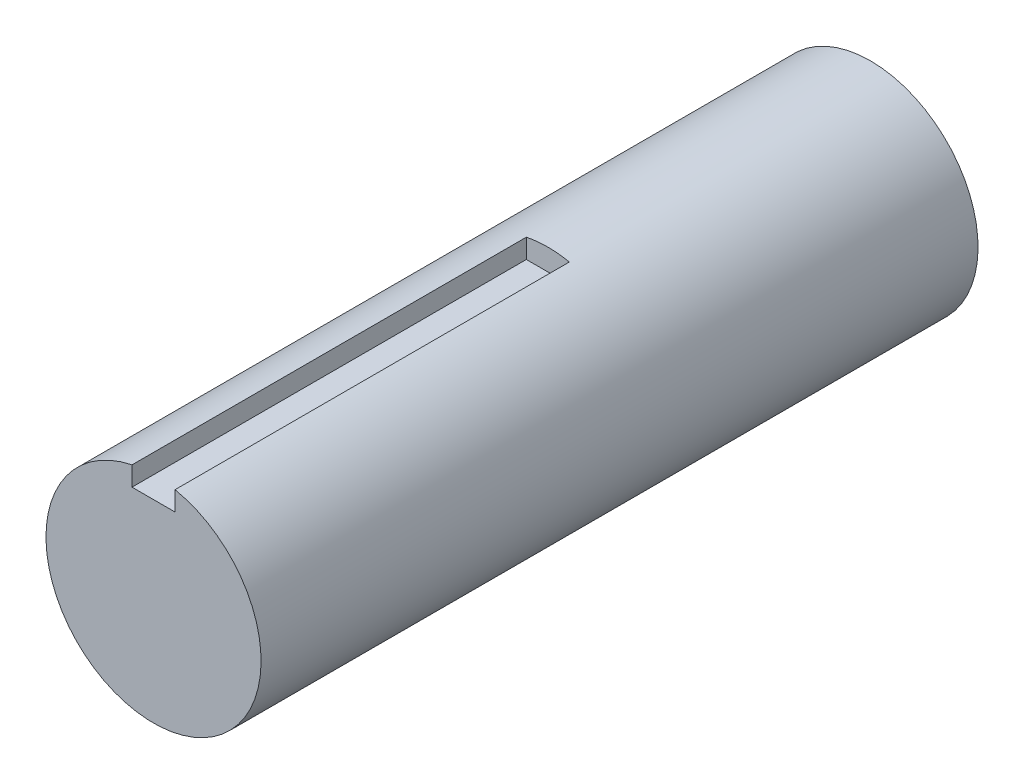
SolidWorks part; units mm, degrees
ref_plane "Front Plane" through (0, 0, 0) normal (0, 0, 1) x (1, 0, 0)
ref_plane "Top Plane" through (0, 0, 0) normal (0, 1, 0) x (1, 0, 0)
ref_plane "Right Plane" through (0, 0, 0) normal (1, 0, 0) x (0, 0, -1)
sketch "Sketch1" plane through (0, 0, 0) normal (1, 0, 0) x (0, 0, -1)
  line L1 (0, 0) -> (-100, 0)
  line L2 (0, 0) -> (0, 15)
  line L3 (0, 15) -> (-100, 15)
  line L4 (-100, 0) -> (-100, 15)
  dimension "D1" = 15
  dimension "D2" = 100
revolve "Revolve1" add sketch "Sketch1" angle 360 about L1
sketch "Sketch2" plane through (0, 0, 100) normal (0, 0, 1) x (1, 0, 0)
  line L1 (-3, 12) -> (3, 12)
  line L2 (-3, 12) -> (-3, 18)
  line L3 (-3, 18) -> (3, 18)
  line L4 (3, 12) -> (3, 18)
  line L5 (-3, 12) -> (3, 18) construction
  line L6 (-3, 18) -> (3, 12) construction
  circle A0 centre (0, 0) radius 15 construction
  point P0 (0, 15)
  dimension "D1" = 6
  dimension "D2" = 6
extrude "Cut-Extrude1" cut sketch "Sketch2" against normal blind 55
